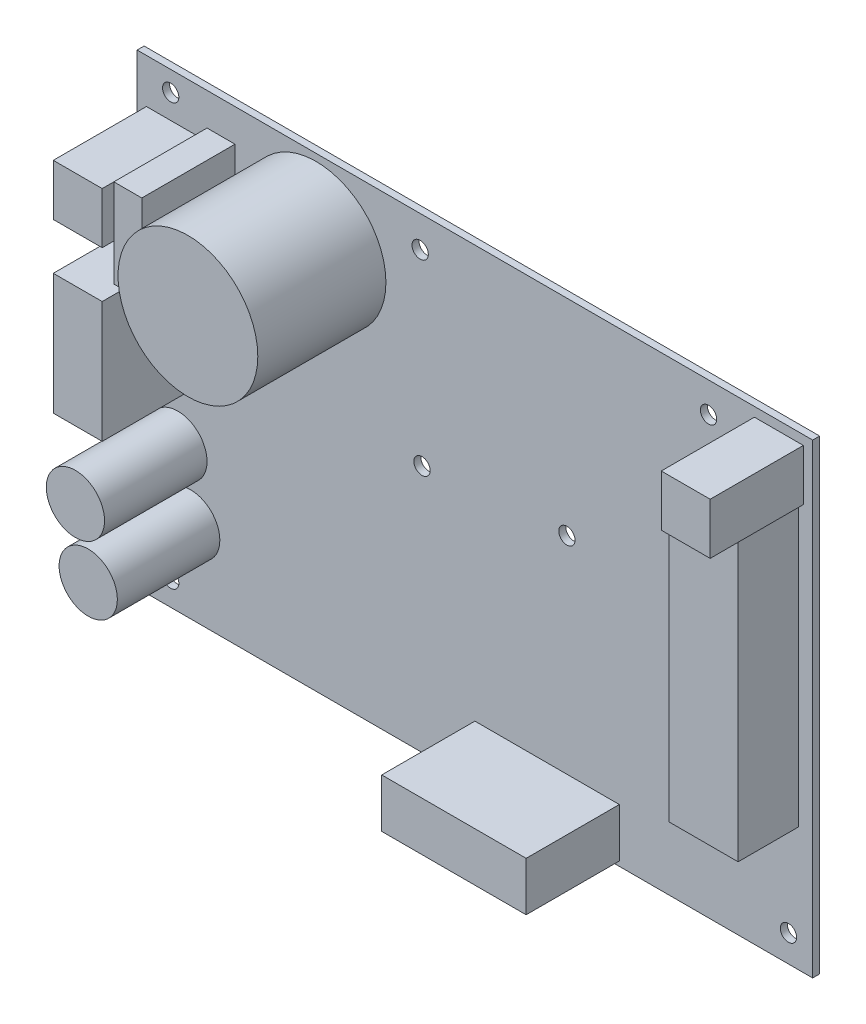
SolidWorks part; units mm, degrees
ref_plane "Přední rovina" through (0, 0, 0) normal (0, 0, 1) x (1, 0, 0)
ref_plane "Horní rovina" through (0, 0, 0) normal (0, 1, 0) x (1, 0, 0)
ref_plane "Pravá rovina" through (0, 0, 0) normal (1, 0, 0) x (0, 0, -1)
sketch "Skica1" plane through (0, 0, 0) normal (0, 0, 1) x (1, 0, 0)
  line L1 (-43.0893, 63.4536) -> (101.9107, 63.4536)
  line L2 (-43.0893, 63.4536) -> (-43.0893, -36.5464)
  line L3 (-43.0893, -36.5464) -> (101.9107, -36.5464)
  line L4 (101.9107, 63.4536) -> (101.9107, -36.5464)
  circle A0 centre (-35.8893, 59.1536) radius 1.75
  circle A1 centre (-35.8893, -31.2464) radius 1.75
  circle A2 centre (96.7107, -30.7464) radius 1.75
  circle A3 centre (78.6607, 43.0036) radius 1.75
  circle A4 centre (79.5607, 57.0036) radius 1.75
  circle A5 centre (49.1607, 19.3036) radius 1.75
  circle A6 centre (18.0607, 16.7036) radius 1.75
  circle A7 centre (17.6607, 56.7036) radius 1.75
  dimension "D3" = 3.5
  dimension "D1" = 145
  dimension "D2" = 100
  dimension "D4" = 5.2
  dimension "D5" = 7.2
  dimension "D6" = 5.3
  dimension "D7" = 5.8
  dimension "D8" = 4.3
  dimension "D9" = 7.2
  dimension "D10" = 6.75
  dimension "D11" = 6.45
  dimension "D12" = 46.75
  dimension "D13" = 44.15
  dimension "D14" = 20.45
  dimension "D15" = 22.35
  dimension "D16" = 23.25
  dimension "D17" = 60.75
  dimension "D18" = 61.15
  dimension "D19" = 52.75
extrude "Přidat vysunutím1" add sketch "Skica1" along normal blind 1.5
sketch "Skica2" plane through (0, 0, 1.5) normal (0, 0, 1) x (1, 0, 0)
  line L0 (-43.0893, 63.4536) -> (-43.0893, -36.5464) construction
  line L1 (-41.0893, 53.9536) -> (-30.5893, 53.9536)
  line L2 (-41.0893, 53.9536) -> (-41.0893, 42.9536)
  line L3 (-41.0893, 42.9536) -> (-30.5893, 42.9536)
  line L4 (-30.5893, 53.9536) -> (-30.5893, 42.9536)
  line L5 (-41.0893, 32.9536) -> (-30.5893, 32.9536)
  line L6 (-41.0893, 32.9536) -> (-41.0893, 6.9536)
  line L7 (-41.0893, 6.9536) -> (-30.5893, 6.9536)
  line L8 (-30.5893, 32.9536) -> (-30.5893, 6.9536)
  line L9 (89.4107, 61.4536) -> (99.9107, 61.4536)
  line L10 (89.4107, 61.4536) -> (89.4107, 50.4536)
  line L11 (89.4107, 50.4536) -> (99.9107, 50.4536)
  line L12 (99.9107, 61.4536) -> (99.9107, 50.4536)
  line L13 (29.4107, -25.0464) -> (60.4107, -25.0464)
  line L14 (29.4107, -25.0464) -> (29.4107, -35.5464)
  line L15 (29.4107, -35.5464) -> (60.4107, -35.5464)
  line L16 (60.4107, -25.0464) -> (60.4107, -35.5464)
  line L17 (-28.0893, 56.4536) -> (-22.0893, 56.4536)
  line L18 (-28.0893, 56.4536) -> (-28.0893, 37.4536)
  line L19 (-28.0893, 37.4536) -> (-22.0893, 37.4536)
  line L20 (-22.0893, 56.4536) -> (-22.0893, 37.4536)
  line L21 (101.9107, -36.5464) -> (101.9107, 63.4536) construction
  line L22 (-43.0893, -36.5464) -> (101.9107, -36.5464) construction
  line L23 (101.9107, 63.4536) -> (-43.0893, 63.4536) construction
  dimension "D1" = 10.5
  dimension "D2" = 31
  dimension "D3" = 11
  dimension "D4" = 11
  dimension "D5" = 26
  dimension "D6" = 19
  dimension "D7" = 6
  dimension "D8" = 2
  dimension "D9" = 2
  dimension "D10" = 2
  dimension "D11" = 41.5
  dimension "D12" = 1
  dimension "D13" = 2
  dimension "D14" = 43.5
  dimension "D15" = 10
  dimension "D16" = 15
  dimension "D17" = 7
extrude "Přidat vysunutím2" add sketch "Skica2" along normal blind 20
sketch "Skica3" plane through (0, 0, 1.5) normal (0, 0, 1) x (1, 0, 0)
  line L0 (-43.0893, 63.4536) -> (-43.0893, -36.5464) construction
  line L3 (101.9107, 63.4536) -> (-43.0893, 63.4536) construction
  circle A0 centre (-4.6893, 46.9536) radius 15
  dimension "D1" = 30
  dimension "D2" = 38.4
  dimension "D3" = 16.5
extrude "Přidat vysunutím3" add sketch "Skica3" along normal blind 27.5
sketch "Skica4" plane through (0, 0, 1.5) normal (0, 0, 1) x (1, 0, 0)
  line L0 (101.9107, -36.5464) -> (101.9107, 63.4536) construction
  line L1 (84.1107, 50.0536) -> (98.9107, 50.0536)
  line L2 (84.1107, 50.0536) -> (84.1107, -9.9464)
  line L3 (84.1107, -9.9464) -> (98.9107, -9.9464)
  line L4 (98.9107, 50.0536) -> (98.9107, -9.9464)
  line L5 (-43.0893, -36.5464) -> (101.9107, -36.5464) construction
  dimension "D1" = 14.8
  dimension "D2" = 60
  dimension "D3" = 3
  dimension "D4" = 26.6
extrude "Přidat vysunutím4" add sketch "Skica4" along normal blind 13
sketch "Skica6" plane through (0, 0, 1.5) normal (0, 0, 1) x (1, 0, 0)
  line L0 (-43.0893, 63.4536) -> (-43.0893, -36.5464) construction
  line L1 (-43.0893, -36.5464) -> (101.9107, -36.5464) construction
  circle A0 centre (-34.3393, -5.5464) radius 6.25
  circle A1 centre (-31.5893, -18.7964) radius 6.25
  dimension "D1" = 12.5
  dimension "D2" = 8.75
  dimension "D3" = 11.5
  dimension "D4" = 17.75
  dimension "D5" = 31
extrude "Přidat vysunutím5" add sketch "Skica6" along normal blind 22 separate body
